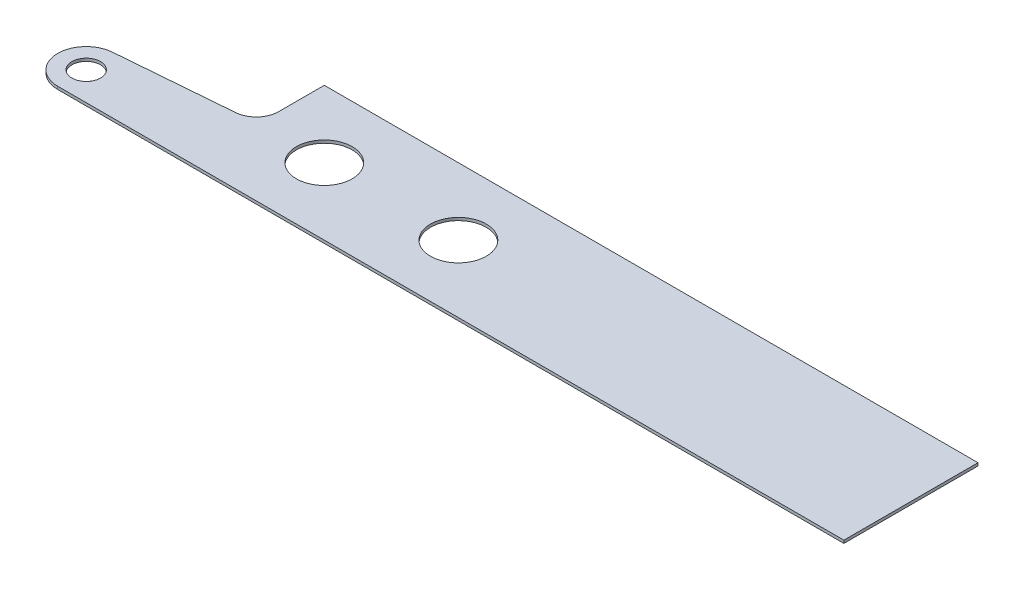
SolidWorks part; units mm, degrees
ref_plane "Front Plane" through (0, 0, 0) normal (0, 0, 1) x (1, 0, 0)
ref_plane "Top Plane" through (0, 0, 0) normal (0, 1, 0) x (1, 0, 0)
ref_plane "Right Plane" through (0, 0, 0) normal (1, 0, 0) x (0, 0, -1)
sketch "Sketch1" plane through (0, 0, 0) normal (0, 1, 0) x (1, 0, 0)
  line L0 (0, 0) -> (0, 14.9391) construction
  line L1 (-9.525, -4.7625) -> (9.525, -4.7625)
  line L2 (-9.525, -4.7625) -> (-9.525, 4.7625)
  line L3 (-9.525, 4.7625) -> (9.525, 4.7625)
  line L4 (9.525, -4.7625) -> (9.525, 4.7625)
  line L5 (-9.525, -4.7625) -> (9.525, 4.7625) construction
  line L6 (-9.525, 4.7625) -> (9.525, -4.7625) construction
  line L7 (0, 0) -> (-34.5199, 0) construction
  circle A0 centre (-4.7625, 0) radius 1.9812
  circle A1 centre (4.7625, 0) radius 1.9812
  point P0 (0, 0)
  dimension "D3" = 3.9624
  dimension "D4" = 9.525
  dimension "D1" = 9.525
  dimension "D2" = 19.05
extrude "Boss-Extrude1" add sketch "Sketch1" along normal blind 0.2032
sketch "Sketch2" plane through (0, 0.2032, 0) normal (0, 1, 0) x (1, 0, 0)
  line L0 (-9.525, -4.7625) -> (-18.9324, -4.7625)
  line L1 (-19.0965, -0.7239) -> (-10.9837, -0.0635)
  line L2 (-9.525, 4.7625) -> (-9.525, -4.7625) construction
  line L3 (-9.525, 1.5188) -> (-9.525, -4.7625)
  arc A0 (-18.9324, -4.7625) -> (-19.0965, -0.7239) centre (-18.9324, -2.7399) cw
  arc A1 (-10.9837, -0.0635) -> (-9.525, 1.5188) centre (-11.1125, 1.5188) ccw
  dimension "D4" = 1.5875
  dimension "D1" = 11.43
  dimension "D2" = 4.0386
  dimension "D3" = 4.699
extrude "Boss-Extrude2" add sketch "Sketch2" against normal blind 0.2032
sketch "Sketch3" plane through (0, 0.2032, 0) normal (0, 1, 0) x (1, 0, 0)
  circle A0 centre (-18.9324, -2.7399) radius 1.016
  dimension "D1" = 2.032
extrude "Cut-Extrude1" cut sketch "Sketch3" against normal through all
sketch "Sketch4" plane through (0, 0.2032, 0) normal (0, 1, 0) x (1, 0, 0)
  line L0 (-18.9324, -4.7625) -> (9.525, -4.7625) construction
  line L1 (9.525, 4.7625) -> (36.9062, 4.7625)
  line L2 (9.525, 4.7625) -> (9.525, -4.7625)
  line L3 (9.525, -4.7625) -> (36.9062, -4.7625)
  line L4 (36.9062, 4.7625) -> (36.9062, -4.7625)
  dimension "D1" = 27.3812
extrude "Boss-Extrude3" add sketch "Sketch4" against normal blind 0.2032
sketch "Sketch5" plane through (0, 0, 0) normal (0, -1, 0) x (1, 0, 0)
  line L0 (35.8069, 1.0597) -> (33.6875, -1.0597)
  line L1 (36.9062, 0) -> (38.6943, 0) construction
  line L2 (36.9062, 4.7625) -> (36.9062, -4.7625) construction
  line L3 (34.7472, 0) -> (34.7472, 6.7263) construction
  line L4 (9.525, 4.7625) -> (9.525, -4.7625) construction
  dimension "D1" = 45
  dimension "D2" = 2.9972
  dimension "D3" = 25.2222
extrude "Extrude-Thin1" add sketch "Sketch5" along normal blind 0.254 thin
fillet "Fillet1" radius 0.127 2 edges at (34.6574, -0.254, 0.0898) (34.837, -0.254, -0.0898)
